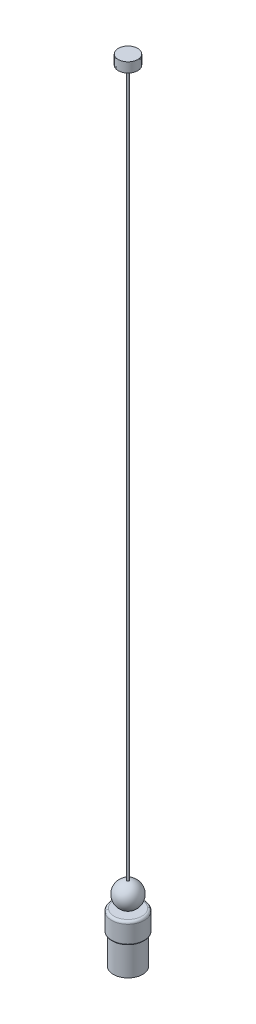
SolidWorks part; units mm, degrees
ref_plane "Alzado" through (0, 0, 0) normal (0, 0, 1) x (1, 0, 0)
ref_plane "Planta" through (0, 0, 0) normal (0, 1, 0) x (1, 0, 0)
ref_plane "Vista lateral" through (0, 0, 0) normal (1, 0, 0) x (0, 0, -1)
imported_body "PORTATIL CERĶMICA.IGS"
delete or keep bodies "Sólido-Eliminar/Conservar 1" type delete bodies bodies 103
delete or keep bodies "Sólido-Eliminar/Conservar 2" type delete bodies bodies 104
ref_plane "Plano1" through (0, 0, 200) normal (0, 0, 1) x (1, 0, 0)
sketch "Croquis3" plane through (0, 0, 200) normal (0, 0, 1) x (1, 0, 0)
  line L0 (25.8849, 275.6947) -> (25.8849, -118.9589) construction
  line L1 (92.8849, 105.3745) -> (-41.1151, 105.3745) construction
  line L2 (-10.869, 115.3745) -> (82.8849, 115.3745) construction
  line L3 (-10.869, 115.3745) -> (82.8849, 115.3745) construction
  line L4 (25.8849, 115.3745) -> (25.8849, 215.3745)
  arc A0 (25.8849, 115.3745) -> (25.8849, 215.3745) centre (25.8849, 165.3745) ccw
  point P6 (25.8849, 105.3745)
  dimension "D1" = 100
revolve "Revolución6" add sketch "Croquis3" angle 360 about L0
ref_plane "Plano2" through (0, 115.3745, 0) normal (0, -1, 0) x (-1, 0, 0)
sketch "Croquis5" plane through (0, 115.3745, 0) normal (0, -1, 0) x (-1, 0, 0)
  circle A0 centre (-25.8849, -200) radius 5
  circle A3 centre (-25.8849, -200) radius 50 construction
  dimension "D1" = 10
extrude "Saliente-Extruir1" add sketch "Croquis5" against normal blind 3000 separate body
sketch "Croquis6" plane through (0, 3115.3745, 0) normal (0, 1, 0) x (1, 0, 0)
  circle A0 centre (25.8849, -200) radius 40
  dimension "D1" = 80
extrude "Saliente-Extruir2" add sketch "Croquis6" along normal blind 40
